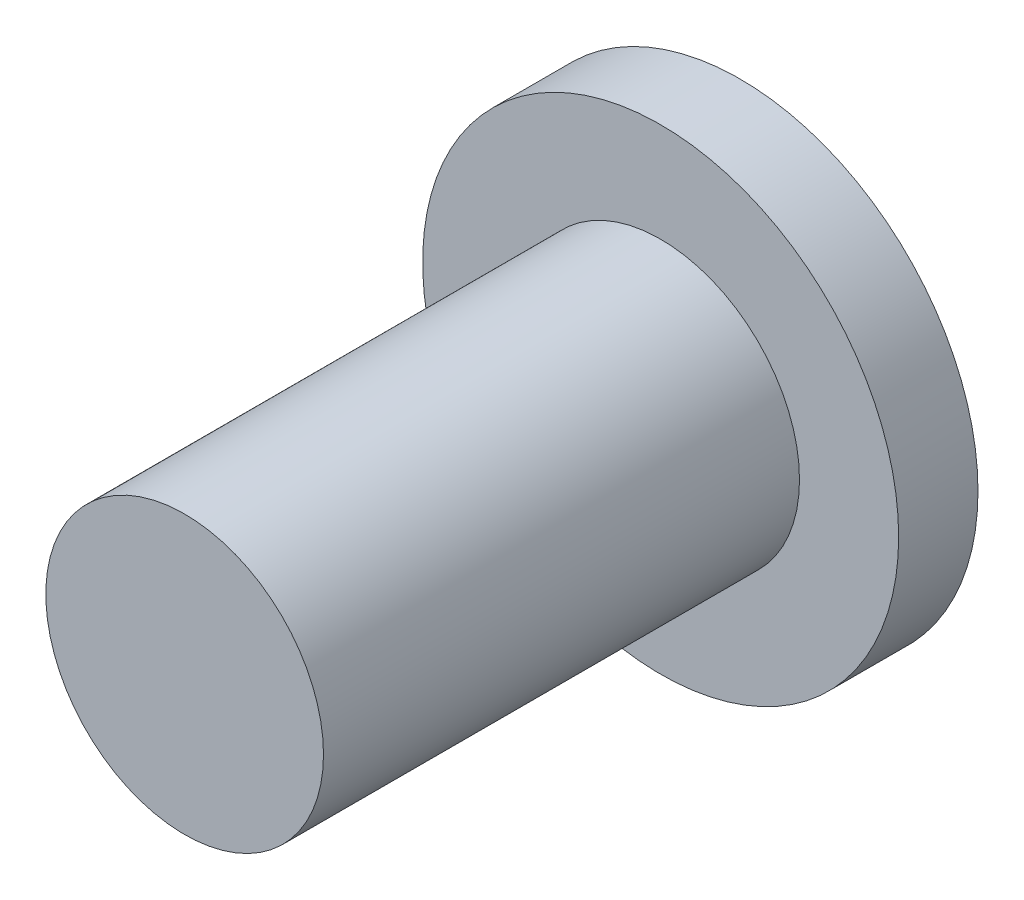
SolidWorks part; units mm, degrees
ref_plane "Plan de face" through (0, 0, 0) normal (0, 0, 1) x (1, 0, 0)
ref_plane "Plan de dessus" through (0, 0, 0) normal (0, 1, 0) x (1, 0, 0)
ref_plane "Plan de droite" through (0, 0, 0) normal (1, 0, 0) x (0, 0, -1)
sketch "Esquisse1" plane through (0, 0, 0) normal (0, 0, 1) x (1, 0, 0)
  circle A0 centre (0, 0) radius 6
  dimension "D1" = 12
extrude "Boss.-Extru.1" add sketch "Esquisse1" along normal blind 14
sketch "Esquisse2" plane through (0, 0, 14) normal (0, 0, 1) x (1, 0, 0)
  circle A0 centre (0, 0) radius 3.5
  dimension "D1" = 7
extrude "Enlèv. mat.-Extru.2" cut sketch "Esquisse2" against normal blind 12 flip side to cut
